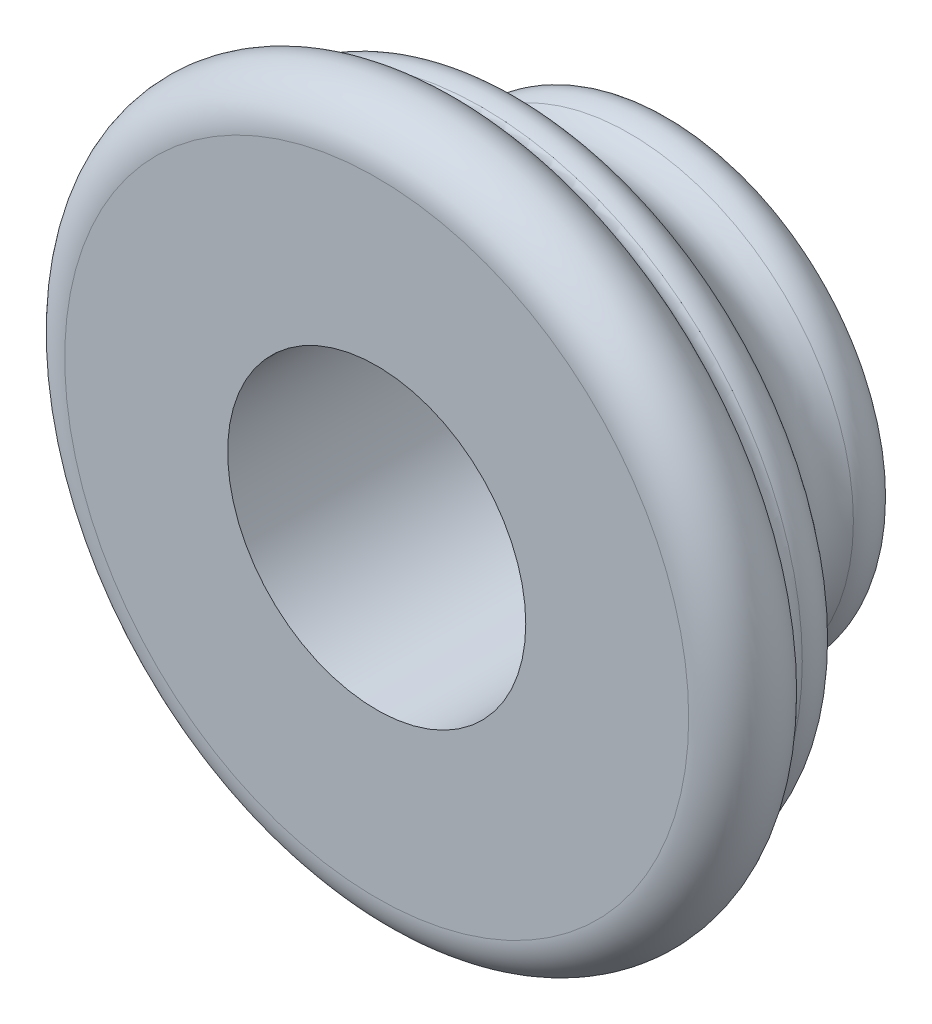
SolidWorks part; units mm, degrees
ref_plane "Спереди" through (0, 0, 0) normal (0, 0, 1) x (1, 0, 0)
ref_plane "Сверху" through (0, 0, 0) normal (0, 1, 0) x (1, 0, 0)
ref_plane "Справа" through (0, 0, 0) normal (1, 0, 0) x (0, 0, -1)
sketch "Эскиз1" plane through (0, 0, 0) normal (1, 0, 0) x (0, 0, -1)
  line L0 (-7.0792, 0) -> (17, 0) construction
  line L1 (-7.0792, 11.965) -> (10, 11.965) construction
  line L2 (0, 11.965) -> (0, 0) construction
  line L3 (6.2397, 7.267) -> (12.709, 7.267) construction
  line L4 (0, 8.575) -> (10, 8.575) construction
  line L5 (0, 7.655) -> (10, 7.655) construction
  line L6 (0, 9.8) -> (10, 9.8) construction
  line L7 (0, 10.465) -> (0, 5)
  line L8 (10, 6.655) -> (10, 5)
  line L9 (0, 5) -> (10, 5)
  line L10 (10, 11.965) -> (10, 5) construction
  arc A0 (2.8962, 11.0134) -> (0, 10.465) centre (1.5, 10.465) ccw
  arc A1 (10, 6.655) -> (8.4804, 7.5094) centre (9, 6.655) ccw
  arc A3 (4.7655, 10.3177) -> (3.5443, 10.7308) centre (3.9099, 9.8) ccw
  arc A6 (3.5443, 10.7308) -> (2.8962, 11.0134) centre (3.3616, 11.1962) cw
  spline S0 degree 3 poles (8.4804, 7.5094) (7.1743, 6.7152) (6.2106, 7.9296) (4.7655, 10.3177) knots 0 0 0 0 1 1 1 1
  dimension "D5" = 3
  dimension "D7" = 5
  dimension "D8" = 1
  dimension "D10" = 0.5
  dimension "D11" = 5.465
  dimension "D12" = 2
  dimension "D1" = 11.965
  dimension "D2" = 7.267
  dimension "D3" = 8.575
  dimension "D6" = 9.8
  dimension "D9" = 10
  dimension "D13" = 7.655
revolve "Повернуть1" add sketch "Эскиз1" angle 360 about L0
